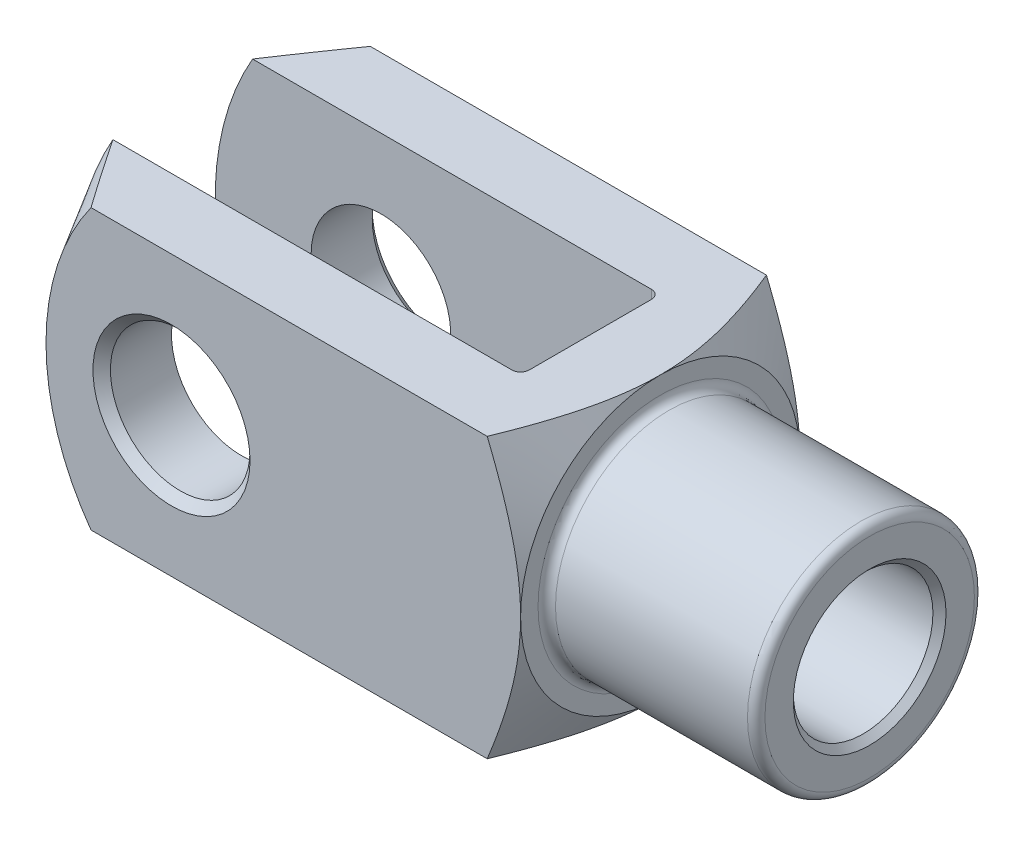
SolidWorks part; units mm, degrees
ref_plane "Front Plane" through (0, 0, 0) normal (0, 0, 1) x (1, 0, 0)
ref_plane "Top Plane" through (0, 0, 0) normal (0, 1, 0) x (1, 0, 0)
ref_plane "Right Plane" through (0, 0, 0) normal (1, 0, 0) x (0, 0, -1)
sketch "Sketch1" plane through (0, 0, 0) normal (1, 0, 0) x (0, 0, -1)
  line L0 (0, 0) -> (0, 50000) construction
  line L1 (0, 0) -> (50000, 0) construction
  line L2 (-16, -16) -> (-16, 16)
  line L3 (-16, 16) -> (16, 16)
  line L4 (16, -16) -> (16, 16)
  line L5 (-16, -16) -> (16, -16)
  point P9 (0, 16)
  point P11 (16, 0)
  point P12 (-16, 0)
  dimension "D1" = 32
  dimension "D2" = 32
extrude "Extrude1" add sketch "Sketch1" against normal blind 83
sketch "Sketch2" plane through (0, 0, 0) normal (1, 0, 0) x (0, 0, -1)
  circle A0 centre (0, 0) radius 13
  circle A1 centre (0, 0) radius 26
  dimension "D1" = 26
  dimension "D2" = 52
extrude "Extrude2" cut sketch "Sketch2" against normal blind 24
sketch "Sketch3" plane through (0, 0, 16) normal (0, 0, 1) x (1, 0, 0)
  circle A0 centre (-64, 0) radius 8
  dimension "D1" = 16
  dimension "D2" = 64
extrude "Extrude3" cut sketch "Sketch3" against normal through all
sketch "Sketch4" plane through (0, 16, 0) normal (0, 1, 0) x (1, 0, 0)
  line L0 (0, 0) -> (-50000, 0) construction
  line L1 (-83, -8) -> (-83, 8)
  line L2 (-83, 16) -> (-83, -16) construction
  line L3 (-83, 8) -> (-32, 8)
  line L4 (-32, 8) -> (-32, -8)
  line L5 (-64, 16) -> (-64, -16) construction
  line L6 (-83, -8) -> (-32, -8)
  point P7 (-64, 0)
  point P13 (-32, 0)
  point P14 (-83, 0)
  dimension "D1" = 32
  dimension "D2" = 16
extrude "Extrude4" cut sketch "Sketch4" against normal through all
fillet "Fillet1" radius 1 2 edges at (-32, 0, 8) (-32, 0, -8)
fillet "Fillet2" radius 1 2 edges at (0, 0, -13) (-24, 0, -13)
chamfer "Chamfer2" distance 1 angle 45 2 edges at (-56, 0, -16) (-56, 0, 16)
sketch "Sketch6" plane through (0, 0, 0) normal (0, 0, 1) x (1, 0, 0)
  line L0 (-24, -16) -> (-24, -32)
  line L1 (-24, -32) -> (-33.2376, -32)
  line L2 (-33.2376, -32) -> (-24, -16)
  dimension "D1" = 30
  dimension "D2" = 32
revolve "Cut-Revolve1" cut sketch "Sketch6" angle 360 about axis through (-24, 0, 0) along (1, 0, 0)
sketch "Sketch7" plane through (0, 0, 0) normal (0, 1, 0) x (1, 0, 0)
  line L0 (-78.3812, -16) -> (-83, -8)
  line L1 (-83, 8) -> (-78.3812, 16)
  line L2 (-78.3812, 16) -> (-115, 16)
  line L3 (-83, 8) -> (-83, -8)
  line L4 (-115, 16) -> (-115, -16)
  line L5 (-115, -16) -> (-78.3812, -16)
  line L6 (-83, 16) -> (-27.8263, 16) construction
  line L7 (-83, -16) -> (-27.8263, -16) construction
  line L8 (-51, 0.6162) -> (-51, 50000.6162) construction
  dimension "D1" = 120
  dimension "D2" = 32
  dimension "D3" = 32
revolve "Cut-Revolve2" cut sketch "Sketch7" angle 180 about L8
sketch "Sketch8" plane through (0, 0, 0) normal (1, 0, 0) x (0, 0, -1)
  circle A0 centre (0, 0) radius 8
  dimension "D1" = 16
extrude "Extrude5" cut sketch "Sketch8" against normal through all
chamfer "Chamfer3" distance 0.75 angle 45 1 edges at (0, 0, -8)
equation "\"D2@Sketch1\" = \"D1@Sketch1\""
equation "\"D2@Sketch2\" = \"D1@Sketch2\"*2"
equation "\"D2@Sketch6\" = \"D1@Sketch1\""
equation "\"D2@Sketch7\" = \"D1@Sketch1\""
equation "\"D3@Sketch7\" = \"D1@Sketch1\""
